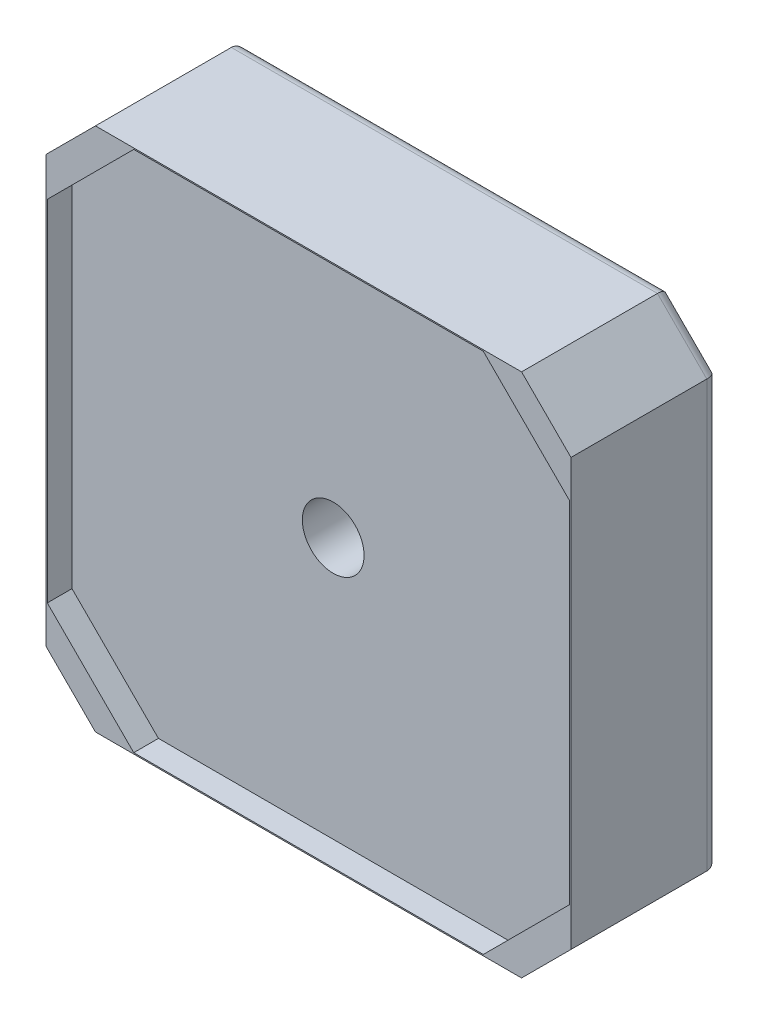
SolidWorks part; units mm, degrees
ref_plane "Front Plane" through (0, 0, 0) normal (0, 0, 1) x (1, 0, 0)
ref_plane "Top Plane" through (0, 0, 0) normal (0, 1, 0) x (1, 0, 0)
ref_plane "Right Plane" through (0, 0, 0) normal (1, 0, 0) x (0, 0, -1)
sketch "Sketch1" plane through (0, 0, 0) normal (0, 0, 1) x (1, 0, 0)
  line L0 (-21.25, 17.25) -> (-17.25, 21.25)
  line L1 (-17.25, -21.25) -> (17.25, -21.25)
  line L2 (-21.25, -17.25) -> (-21.25, 17.25)
  line L3 (-17.25, 21.25) -> (17.25, 21.25)
  line L4 (21.25, -17.25) -> (21.25, 17.25)
  line L5 (-21.25, -21.25) -> (21.25, 21.25) construction
  line L6 (-21.25, 21.25) -> (21.25, -21.25) construction
  line L7 (17.25, 21.25) -> (21.25, 17.25)
  line L8 (17.25, -21.25) -> (21.25, -17.25)
  line L9 (-21.25, -17.25) -> (-17.25, -21.25)
  point P0 (0, 0)
  dimension "D1" = 42.5
  dimension "D2" = 42.5
extrude "Boss-Extrude1" add sketch "Sketch1" along normal blind 12
sketch "Sketch2" plane through (0, 0, 12) normal (0, 0, 1) x (1, 0, 0)
  line L0 (-21.15, 14.15) -> (-14.15, 21.15)
  line L1 (-14.15, -21.15) -> (14.15, -21.15)
  line L2 (-21.15, -14.15) -> (-21.15, 14.15)
  line L3 (-14.15, 21.15) -> (14.15, 21.15)
  line L4 (21.15, -14.15) -> (21.15, 14.15)
  line L5 (-21.15, -21.15) -> (21.15, 21.15) construction
  line L6 (-21.15, 21.15) -> (21.15, -21.15) construction
  line L7 (14.15, 21.15) -> (21.15, 14.15)
  line L8 (-21.15, -14.15) -> (-14.15, -21.15)
  line L9 (14.15, -21.15) -> (21.15, -14.15)
  point P0 (0, 0)
  dimension "D1" = 42.3
  dimension "D2" = 42.3
extrude "Cut-Extrude1" cut sketch "Sketch2" against normal blind 2
sketch "Sketch3" plane through (0, 0, 0) normal (0, 0, -1) x (-1, 0, 0)
  circle A0 centre (0, 0) radius 11
  dimension "D1" = 22
extrude "Boss-Extrude2" add sketch "Sketch3" along normal blind 2
sketch "Sketch4" plane through (0, 0, -2) normal (0, 0, -1) x (-1, 0, 0)
  circle A0 centre (0, 0) radius 5.5
  dimension "D1" = 11
extrude "Cut-Extrude2" cut sketch "Sketch4" against normal blind 7
sketch "Sketch5" plane through (0, 0, 5) normal (0, 0, -1) x (-1, 0, 0)
  circle A0 centre (0, 0) radius 2.5
  dimension "D1" = 5
extrude "Cut-Extrude3" cut sketch "Sketch5" against normal through all
fillet "Fillet1" radius 1 8 edges at (19.25, -19.25, 0) (0, -21.25, 0) (-19.25, -19.25, 0) (-21.25, 0, 0) (-19.25, 19.25, 0) (21.25, 0, 0) (19.25, 19.25, 0) (0, 21.25, 0)
fillet "Fillet3" radius 0.5 3 edges at (-5.5, 0, -2) (-5.5, 0, 5) (-11, 0, -2)
sketch "Sketch6" plane through (0, 0, 0) normal (0, 0, -1) x (-1, 0, 0)
  circle A0 centre (-15.5, 15.5) radius 1
  circle A1 centre (15.5, 15.5) radius 1
  circle A2 centre (15.5, -15.5) radius 1
  circle A3 centre (-15.5, -15.5) radius 1
  point P0 (0, 0)
extrude "Cut-Extrude4" cut sketch "Sketch6" against normal blind 3
fillet "Fillet4" radius 0.5 4 edges at (14.5, -15.5, 0) (-16.5, -15.5, 0) (-16.5, 15.5, 0) (14.5, 15.5, 0)
